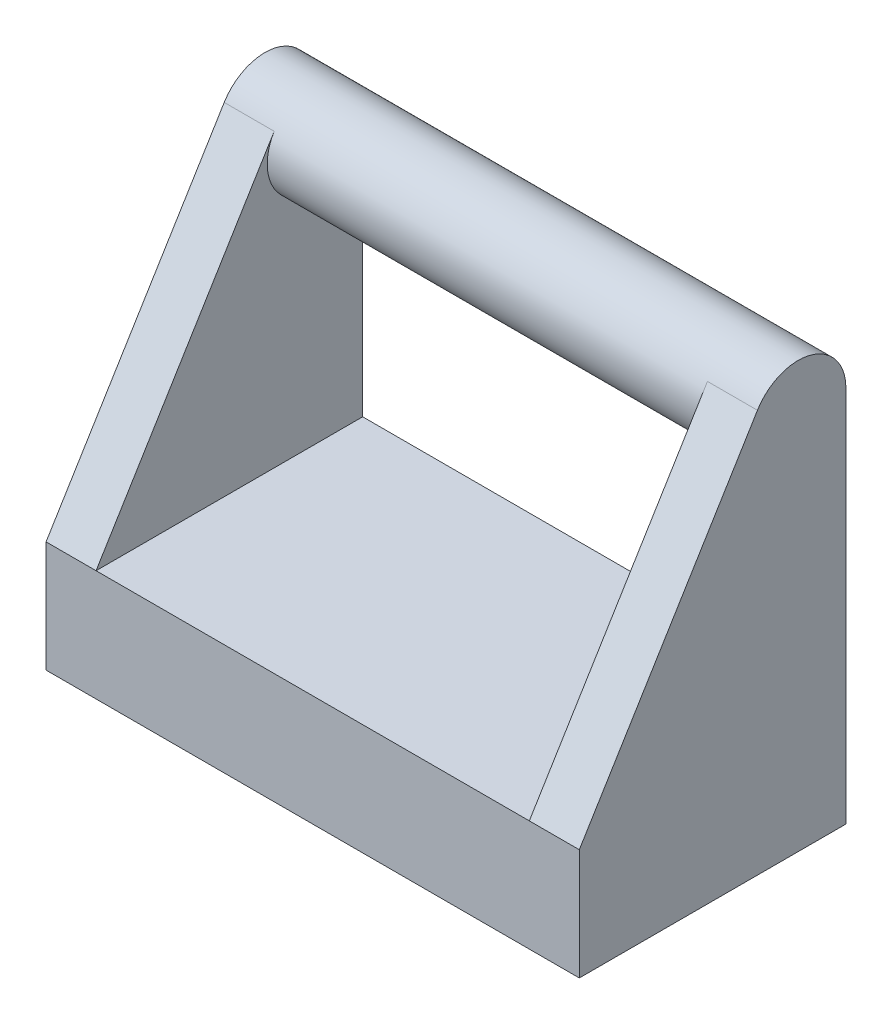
SolidWorks part; units mm, degrees
ref_plane "Plano frontal" through (0, 0, 0) normal (0, 0, 1) x (1, 0, 0)
ref_plane "Plano superior" through (0, 0, 0) normal (0, 1, 0) x (1, 0, 0)
ref_plane "Plano direito" through (0, 0, 0) normal (1, 0, 0) x (0, 0, -1)
sketch "Esboço2" plane through (0, 0, 0) normal (0, 1, 0) x (1, 0, 0)
  line L1 (0, 0) -> (-16, 0)
  line L2 (0, 0) -> (0, 8)
  line L3 (0, 8) -> (-16, 8)
  line L4 (-16, 0) -> (-16, 8)
  dimension "D1" = 8
  dimension "D2" = 16
extrude "Ressalto-extrusão1" add sketch "Esboço2" along normal blind 3.3333
sketch "Esboço3" plane through (0, 0, 0) normal (1, 0, 0) x (0, 0, -1)
  line L0 (0, 3.3333) -> (5.3451, 12.0803)
  line L1 (8, 3.3333) -> (8, 11.3333)
  line L2 (0, 3.3333) -> (8, 3.3333) construction
  circle A0 centre (6.5675, 11.3333) radius 1.4325
  dimension "D1" = 8
extrude "Ressalto-extrusão2" add sketch "Esboço3" against normal blind 1.5 contours A0 L0 L1 M5 | A0
ref_plane "Plano1" through (-8, 0, 0) normal (-1, 0, 0) x (0, 0, 1)
mirror "Espelhar1" about plane through (-8, 0, 0) normal (-1, 0, 0) of "Ressalto-extrusão1", "Ressalto-extrusão2"
sketch "Esboço4" plane through (-16, 0, 0) normal (-1, 0, 0) x (0, 0, 1)
  circle A0 centre (-6.5675, 11.3333) radius 1.4325
  arc A1 (-5.3451, 12.0803) -> (-8, 11.3333) centre (-6.5675, 11.3333) ccw construction
extrude "Ressalto-extrusão3" add sketch "Esboço4" against normal blind 16
sketch "Esboço6" plane through (0, 0, 0) normal (0, -1, 0) x (1, 0, 0)
  line L0 (0, -8) -> (-16, -8) construction
  line L1 (-1, -7) -> (-15, -7)
  line L2 (-1, -7) -> (-1, -1)
  line L3 (-1, -1) -> (-15, -1)
  line L4 (-15, -7) -> (-15, -1)
  line L5 (0, 0) -> (0, -8) construction
  line L6 (-16, 0) -> (0, 0) construction
  line L7 (-16, -8) -> (-16, 0) construction
  dimension "D1" = 1
  dimension "D2" = 1
  dimension "D3" = 1
  dimension "D4" = 1
extrude "Corte-extrusão1" cut sketch "Esboço6" against normal blind 2.3333
sketch "Esboço7" plane through (0, 2.3333, 0) normal (0, -1, 0) x (1, 0, 0)
  circle A0 centre (-8, -4) radius 0.75
  circle A1 centre (-8, -4) radius 1.5
  dimension "D1" = 3
  dimension "D2" = 1.5
extrude "Ressalto-extrusão4" add sketch "Esboço7" along normal blind 2.3333
